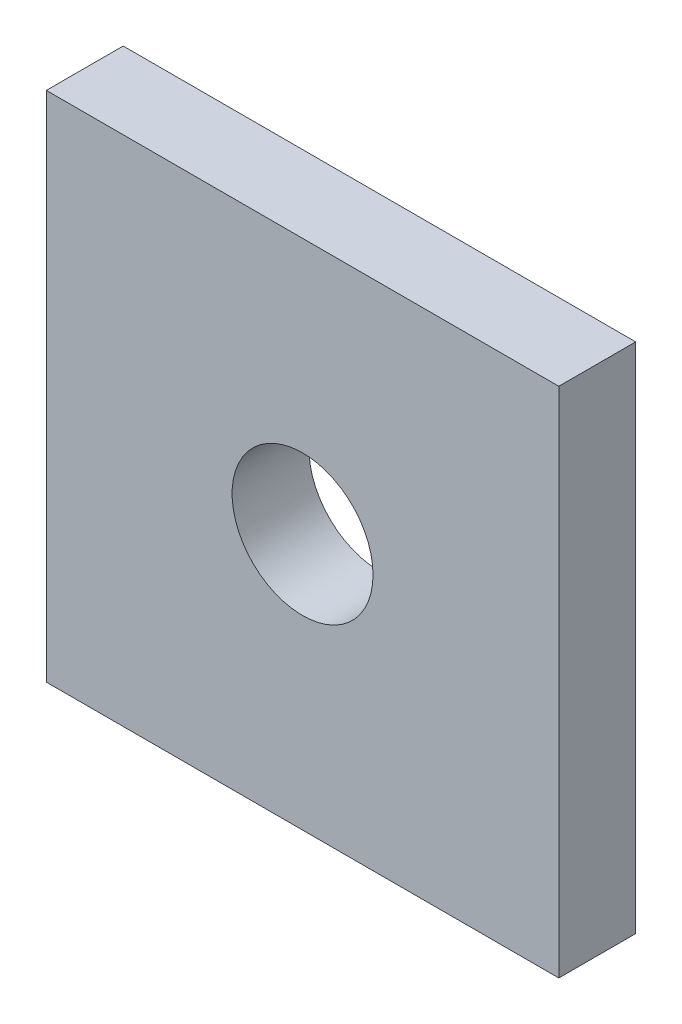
SolidWorks part; units mm, degrees
ref_plane "Front Plane" through (0, 0, 0) normal (0, 0, 1) x (1, 0, 0)
ref_plane "Top Plane" through (0, 0, 0) normal (0, 1, 0) x (1, 0, 0)
ref_plane "Right Plane" through (0, 0, 0) normal (1, 0, 0) x (0, 0, -1)
sketch "Sketch1" plane through (0, 0, 0) normal (0, 0, 1) x (1, 0, 0)
  line L0 (20, 20) -> (0, 0) construction
  line L1 (0, 0) -> (20, 0)
  line L2 (0, 0) -> (0, 20)
  line L3 (0, 20) -> (20, 20)
  line L4 (20, 0) -> (20, 20)
  circle A0 centre (10, 10) radius 2.75
  dimension "D1" = 5.5
  dimension "D2" = 20
  dimension "D3" = 20
extrude "Extrude1" add sketch "Sketch1" along normal blind 3
